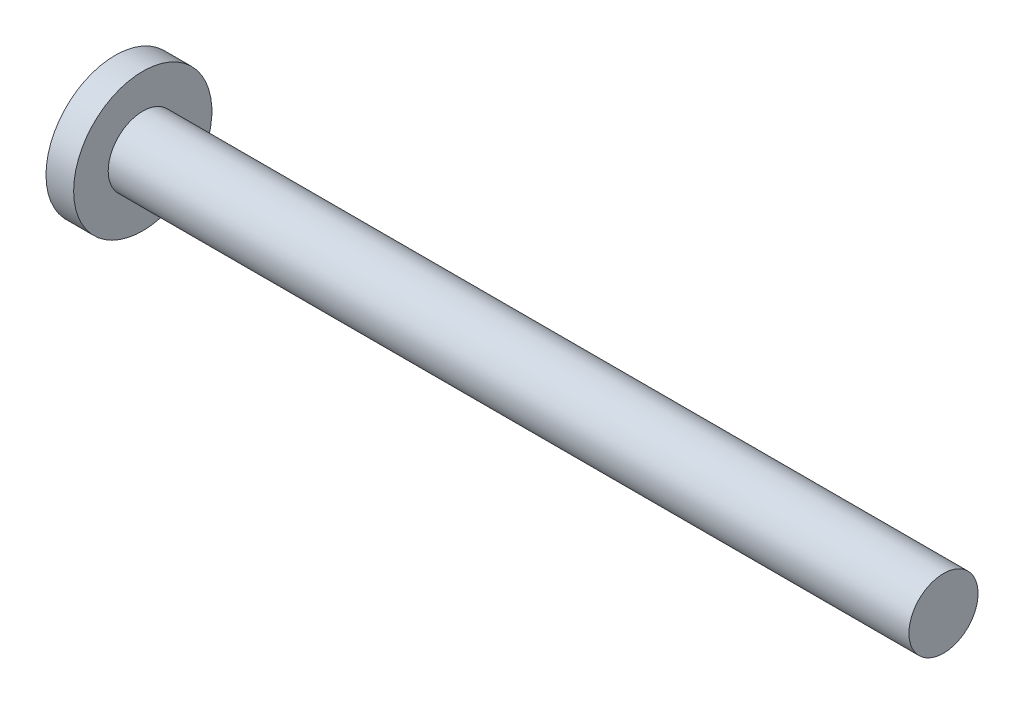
SolidWorks part; units mm, degrees
ref_plane "Front Plane" through (0, 0, 0) normal (0, 0, 1) x (1, 0, 0)
ref_plane "Top Plane" through (0, 0, 0) normal (0, 1, 0) x (1, 0, 0)
ref_plane "Right Plane" through (0, 0, 0) normal (1, 0, 0) x (0, 0, -1)
sketch "Sketch1" plane through (0, 0, 0) normal (0, 0, 1) x (1, 0, 0)
  line L0 (0, 0) -> (0, 3.3909)
  line L1 (0, 3.3909) -> (1.3564, 3.3909)
  line L2 (1.3564, 3.3909) -> (1.3564, 1.6955)
  line L3 (1.3564, 1.6955) -> (40.64, 1.6955)
  line L4 (40.64, 1.6955) -> (40.64, 0)
  line L5 (40.64, 0) -> (0, 0)
  line L6 (40.64, 0) -> (0, 0) construction
revolve "Revolve1" add sketch "Sketch1" angle 360 about L6
ref_plane "Plane1" through (40.64, 0, 0) normal (1, 0, 0) x (0, 0, -1)
